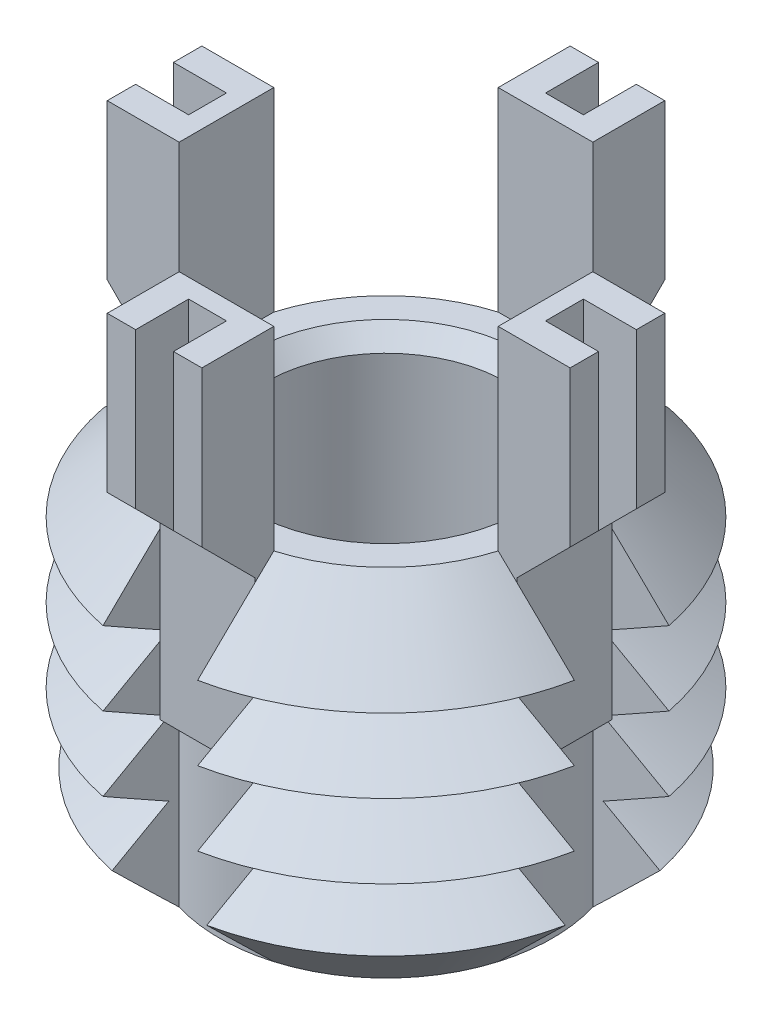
SolidWorks part; units mm, degrees
ref_plane "Front Plane" through (0, 0, 0) normal (0, 0, 1) x (1, 0, 0)
ref_plane "Top Plane" through (0, 0, 0) normal (0, 1, 0) x (1, 0, 0)
ref_plane "Right Plane" through (0, 0, 0) normal (1, 0, 0) x (0, 0, -1)
sketch "Sketch1" plane through (0, 0, 0) normal (0, 1, 0) x (1, 0, 0)
  circle A0 centre (0, 0) radius 6.35
  dimension "D1" = 12.7
extrude "Boss-Extrude1" add sketch "Sketch1" against normal blind 9.398
chamfer "Chamfer1" distance 1.954 angle 45 2 edges at (0, -9.398, 6.35) (0, 0, 6.35)
sketch "Sketch2" plane through (0, 0, 0) normal (1, 0, 0) x (0, 0, -1)
  line L0 (0, 0.8859) -> (0, -9.2617) construction
sketch "Sketch3" plane through (0, 0, 0) normal (1, 0, 0) x (0, 0, -1)
  line L0 (-6.35, -1.954) -> (-4.6578, -2.931)
  line L1 (-4.6578, -2.931) -> (-6.35, -3.908)
  line L2 (-6.35, -1.954) -> (-6.35, -7.444) construction
  line L3 (-6.35, -3.908) -> (-6.35, -1.954)
  dimension "D1" = 1.954
revolve "Cut-Revolve1" cut sketch "Sketch3" angle 360 about L0
pattern_linear "LPattern1" count 3 spacing 1.954 along (0, -1, 0) of "Cut-Revolve1"
sketch "Sketch4" plane through (0, 0, 0) normal (0, 1, 0) x (1, 0, 0)
  line L0 (-4.2145, 1.25) -> (-6.2258, 1.25)
  line L2 (-6.2258, -1.25) -> (-4.2145, -1.25)
  arc A0 (-4.2145, 1.25) -> (-4.2145, -1.25) centre (0, 0) ccw
  arc A1 (-6.2258, 1.25) -> (-6.2258, -1.25) centre (0, 0) ccw
  circle A2 centre (0, 0) radius 6.35 construction
  circle A3 centre (0, 0) radius 4.396 construction
  point P1 (-4.396, 0)
  point P3 (-6.35, 0)
  point P13 (0, 0)
  dimension "D1" = 2.5
extrude "Cut-Extrude1" cut sketch "Sketch4" against normal up to surface (9.398 mm away)
pattern_circular "CirPattern1" count 4 over 360 about axis through (0, 0, 0) along (0, 1, 0) of "Cut-Extrude1"
sketch "Sketch5" plane through (0, 0, 0) normal (1, 0, 0) x (0, 0, -1)
  line L0 (-4.2145, 5.138) -> (-4.2145, -4.862)
  line L1 (-4.2145, -4.862) -> (-4.7145, -4.862)
  line L2 (-4.7145, -4.862) -> (-4.7145, -0.362)
  line L3 (-4.7145, -0.362) -> (-6.1145, 1.038)
  line L4 (-6.1145, 1.038) -> (-6.1145, 5.138)
  line L5 (-6.1145, 5.138) -> (-4.2145, 5.138)
  line L6 (-6.2258, -5.862) -> (-1.25, -5.862) construction
  point P9 (-1.25, 0)
  point P10 (-4.7145, -0.362)
  dimension "D1" = 1
  dimension "D2" = 10
  dimension "D3" = 5.5
  dimension "D4" = 1.9
  dimension "D5" = 0.5
  dimension "D6" = 45
extrude "Boss-Extrude3" add sketch "Sketch5" along normal mid plane 2.5
pattern_circular "CirPattern2" count 4 over 360 about axis through (0, 0, 0) along (0, 1, 0) of "Boss-Extrude3"
sketch "Sketch6" plane through (0, 5.138, 0) normal (0, 1, 0) x (1, 0, 0)
  line L0 (-6.1145, -1.25) -> (-6.1145, 1.25) construction
  line L1 (-6.1145, -0.5) -> (-4.7145, -0.5)
  line L2 (-6.1145, -0.5) -> (-6.1145, 0.5)
  line L3 (-6.1145, 0.5) -> (-4.7145, 0.5)
  line L4 (-4.7145, -0.5) -> (-4.7145, 0.5)
  line L5 (-6.1145, -0.5) -> (-4.7145, 0.5) construction
  line L6 (-6.1145, 0.5) -> (-4.7145, -0.5) construction
  line L7 (6.1145, 1.25) -> (6.1145, -1.25) construction
  line L8 (-0.5, 4.7145) -> (0.5, 4.7145)
  line L9 (-0.5, 4.7145) -> (-0.5, 6.1145)
  line L10 (-0.5, 6.1145) -> (0.5, 6.1145)
  line L11 (0.5, 4.7145) -> (0.5, 6.1145)
  line L12 (-0.5, 4.7145) -> (0.5, 6.1145) construction
  line L13 (-0.5, 6.1145) -> (0.5, 4.7145) construction
  line L14 (4.7145, -0.5) -> (6.1145, -0.5)
  line L15 (4.7145, -0.5) -> (4.7145, 0.5)
  line L16 (4.7145, 0.5) -> (6.1145, 0.5)
  line L17 (6.1145, -0.5) -> (6.1145, 0.5)
  line L18 (4.7145, -0.5) -> (6.1145, 0.5) construction
  line L19 (4.7145, 0.5) -> (6.1145, -0.5) construction
  line L20 (-0.5, -6.1145) -> (0.5, -6.1145)
  line L21 (-0.5, -6.1145) -> (-0.5, -4.7145)
  line L22 (-0.5, -4.7145) -> (0.5, -4.7145)
  line L23 (0.5, -6.1145) -> (0.5, -4.7145)
  line L24 (-0.5, -6.1145) -> (0.5, -4.7145) construction
  line L25 (-0.5, -4.7145) -> (0.5, -6.1145) construction
  line L26 (-1.25, 6.1145) -> (1.25, 6.1145) construction
  line L27 (1.25, -6.1145) -> (-1.25, -6.1145) construction
  point P0 (-5.4145, 0)
  point P7 (-6.1145, 0)
  point P8 (-6.1145, 0)
  point P9 (0, 5.4145)
  point P14 (5.4145, 0)
  point P19 (0, -5.4145)
  point P24 (0, 6.1145)
  point P25 (6.1145, 0)
  point P26 (6.1145, 0)
  point P27 (0, 6.1145)
  point P30 (0, -6.1145)
  point P33 (0, -6.1145)
  dimension "D1" = 1
  dimension "D2" = 1.4
extrude "Cut-Extrude3" cut sketch "Sketch6" against normal through all both and the other way through all
sketch "Sketch7" plane through (0, 0, 0) normal (0, 1, 0) x (1, 0, 0)
  circle A0 centre (0, 0) radius 3.175
  dimension "D1" = 6.35
extrude "Cut-Extrude4" cut sketch "Sketch7" against normal up to surface (9.398 mm away)
chamfer "Chamfer2" distance 0.4535 angle 45 2 edges at (0, 0, 3.175) (0, -9.398, 3.175)
